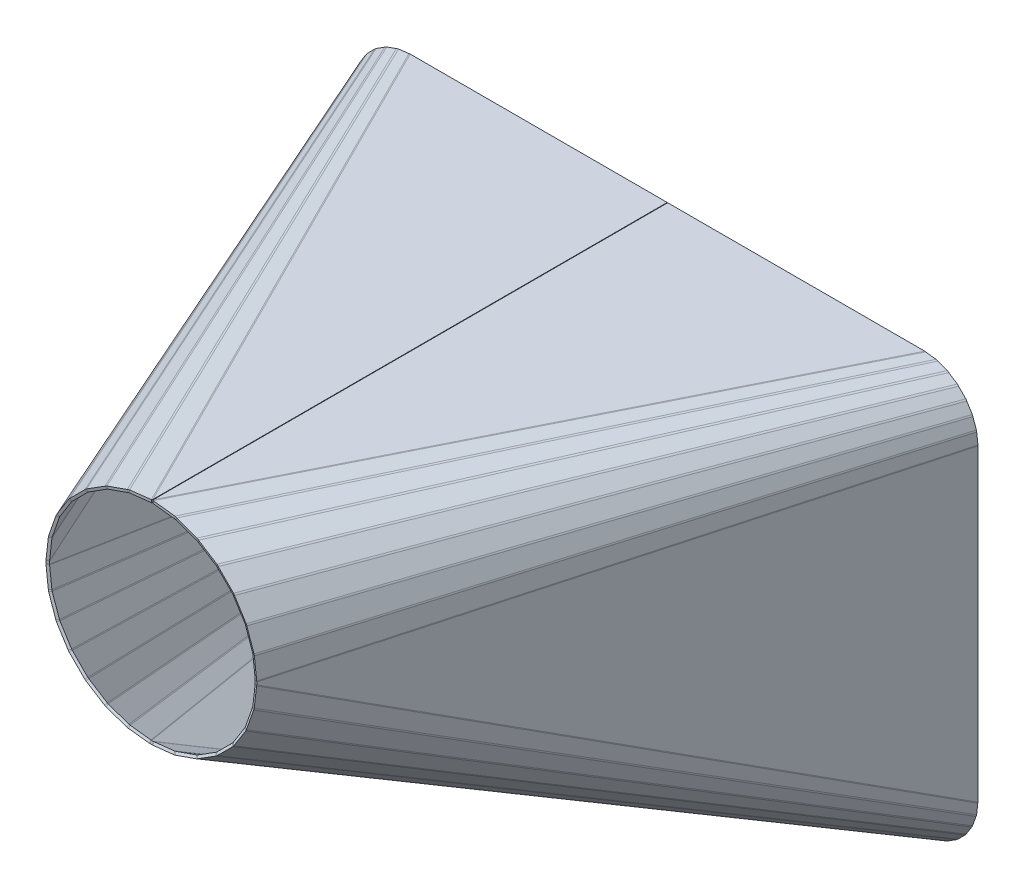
SolidWorks part; units mm, degrees
ref_plane "Front Plane" through (0, 0, 0) normal (0, 0, 1) x (1, 0, 0)
ref_plane "Top Plane" through (0, 0, 0) normal (0, 1, 0) x (1, 0, 0)
ref_plane "Right Plane" through (0, 0, 0) normal (1, 0, 0) x (0, 0, -1)
sketch "Rect Profile" plane through (0, 0, 0) normal (0, 0, 1) x (1, 0, 0)
  line L0 (0, -400) -> (0, 0) construction
  line L1 (-250, 0) -> (-0.25, 0)
  line L2 (-300, -50) -> (-300, -350)
  line L3 (-250, -400) -> (250, -400)
  line L4 (300, -50) -> (300, -350)
  line L5 (0.25, 0) -> (250, 0)
  arc A0 (-300, -350) -> (-250, -400) centre (-250, -350) ccw
  arc A1 (250, -400) -> (300, -350) centre (250, -350) ccw
  arc A2 (250, 0) -> (300, -50) centre (250, -50) cw
  arc A3 (-250, 0) -> (-300, -50) centre (-250, -50) ccw
  point P9 (-300, -400)
  point P14 (300, -400)
  point P17 (300, 0)
ref_plane "Transition Height" through (0, 0, 500) normal (0, 0, 1) x (1, 0, 0)
sketch "Circ Profile" plane through (0, 0, 500) normal (0, 0, 1) x (1, 0, 0)
  line L0 (0, -100) -> (0, 0) construction
  arc A1 (-0.25, -0.0003) -> (0.25, -0.0003) centre (0, -100) ccw
lofted bend "Lofted Bends1" parameters "D1"=0, "D13"=0.5, "D15"=5, "D16"=15, "D17"=0.5, "D19"=5, "D20"=15, "D21"=0.5, "D23"=5, "D24"=15, "D25"=0.5, "D27"=5, "D28"=15, "D29"=0.5, "D31"=5, "D32"=15
bend "RoundBend1" bend radius 5.08 bend angle 7.327 parameters "D5"=1
bend "RoundBend2" bend radius 5.08 bend angle 5.964 parameters "D5"=2
bend "RoundBend3" bend radius 5.08 bend angle 11.886 parameters "D5"=3
bend "RoundBend4" bend radius 5.08 bend angle 12.032 parameters "D5"=4
bend "RoundBend5" bend radius 5.08 bend angle 12.396 parameters "D5"=5
bend "RoundBend6" bend radius 5.08 bend angle 12.925 parameters "D5"=6
bend "RoundBend7" bend radius 5.08 bend angle 13.522 parameters "D5"=7
bend "RoundBend8" bend radius 5.08 bend angle 14.045 parameters "D5"=8
bend "RoundBend9" bend radius 5.08 bend angle 6.448 parameters "D5"=9
bend "RoundBend10" bend radius 5.08 bend angle 6.45 parameters "D5"=10
bend "RoundBend11" bend radius 5.08 bend angle 12.149 parameters "D5"=11
bend "RoundBend12" bend radius 5.08 bend angle 11.422 parameters "D5"=12
bend "RoundBend13" bend radius 5.08 bend angle 11.05 parameters "D5"=13
bend "RoundBend14" bend radius 5.08 bend angle 11.05 parameters "D5"=14
bend "RoundBend15" bend radius 5.08 bend angle 11.422 parameters "D5"=15
bend "RoundBend16" bend radius 5.08 bend angle 12.149 parameters "D5"=16
bend "RoundBend17" bend radius 5.08 bend angle 6.45 parameters "D5"=17
bend "RoundBend18" bend radius 5.08 bend angle 6.448 parameters "D5"=18
bend "RoundBend19" bend radius 5.08 bend angle 12.149 parameters "D5"=19
bend "RoundBend20" bend radius 5.08 bend angle 11.422 parameters "D5"=20
bend "RoundBend21" bend radius 5.08 bend angle 11.05 parameters "D5"=21
bend "RoundBend22" bend radius 5.08 bend angle 11.05 parameters "D5"=22
bend "RoundBend23" bend radius 5.08 bend angle 11.422 parameters "D5"=23
bend "RoundBend24" bend radius 5.08 bend angle 12.149 parameters "D5"=24
bend "RoundBend25" bend radius 5.08 bend angle 5.964 parameters "D5"=25
bend "RoundBend26" bend radius 5.08 bend angle 7.327 parameters "D5"=26
bend "RoundBend27" bend radius 5.08 bend angle 14.045 parameters "D5"=27
bend "RoundBend28" bend radius 5.08 bend angle 13.522 parameters "D5"=28
bend "RoundBend29" bend radius 5.08 bend angle 12.925 parameters "D5"=29
bend "RoundBend30" bend radius 5.08 bend angle 12.396 parameters "D5"=30
bend "RoundBend31" bend radius 5.08 bend angle 12.032 parameters "D5"=31
bend "RoundBend32" bend radius 5.08 bend angle 11.886 parameters "D5"=32
sketch "Bend-Lines1" [suppressed] plane through (0, 0, 0) normal (0, 1, 0) x (1, 0, 0)
sketch "Bounding-Box1" [suppressed] plane through (0, 0, 0) normal (0, 1, 0) x (1, 0, 0)
sheet metal parameters "Sheet-Metal1" thickness 2.6568 parameters "D1"=5.08
flat pattern "Flat-Pattern1"
sketch "Bend-Lines2" plane through (0, -344.7696, 137.9919) normal (0, 0.9284, -0.3716) x (1, 0, 0)
  line L0 (-160.348, -461.8658) -> (-552.607, -90.1847) construction
  line L1 (-175.0026, -479.1109) -> (-560.0295, -98.9056) construction
  line L2 (-188.2211, -497.4826) -> (-566.7382, -108.1896) construction
  line L3 (-200.0623, -516.775) -> (-572.7642, -117.9349) construction
  line L4 (-210.7059, -536.7574) -> (-578.1985, -128.0266) construction
  line L5 (-220.4549, -557.1944) -> (-583.1929, -138.3464) construction
  line L6 (-229.9203, -577.4944) -> (-587.8914, -148.7299) construction
  line L7 (-145.4488, -447.0205) -> (-544.5513, -82.1425) construction
  line L8 (-22.6153, -391.0124) -> (-261.4355, 147.9948) construction
  line L9 (-45.0246, -394.3323) -> (-272.7643, 146.2816) construction
  line L10 (-66.9348, -400.0682) -> (-283.8387, 143.365) construction
  line L11 (-88.0472, -408.2616) -> (-294.5132, 139.2224) construction
  line L12 (-108.0907, -418.8073) -> (-304.6559, 133.9049) construction
  line L13 (-126.873, -431.4733) -> (-314.1746, 127.5275) construction
  line L14 (-143.0917, -444.9021) -> (-322.9744, 120.3008) construction
  line L15 (-1.1464, -389.9655) -> (-250.0644, 148.5963) construction
  line L16 (314.1746, 127.5275) -> (126.873, -431.4733) construction
  line L17 (304.6559, 133.9049) -> (108.0907, -418.8074) construction
  line L18 (294.5132, 139.2224) -> (88.0472, -408.2616) construction
  line L19 (283.8388, 143.365) -> (66.9348, -400.0682) construction
  line L20 (272.7643, 146.2816) -> (45.0246, -394.3323) construction
  line L21 (261.4355, 147.9948) -> (22.6153, -391.0124) construction
  line L22 (250.0645, 148.5963) -> (1.1464, -389.9655) construction
  line L23 (322.9745, 120.3008) -> (143.0935, -444.9036) construction
  line L24 (583.1929, -138.3465) -> (220.4549, -557.1946) construction
  line L25 (578.1985, -128.0266) -> (210.7059, -536.7575) construction
  line L26 (572.7642, -117.9349) -> (200.0623, -516.7751) construction
  line L27 (566.7382, -108.1896) -> (188.2211, -497.4826) construction
  line L28 (560.0295, -98.9056) -> (175.0026, -479.1109) construction
  line L29 (552.607, -90.1847) -> (160.3481, -461.8659) construction
  line L30 (544.5513, -82.1424) -> (145.4471, -447.0189) construction
  line L31 (587.8914, -148.7299) -> (229.9203, -577.4944) construction
  line L32 (-160.348, -461.8658) -> (-552.607, -90.1847) construction
  line L33 (-175.0026, -479.1109) -> (-560.0295, -98.9056) construction
  line L34 (-188.2211, -497.4826) -> (-566.7382, -108.1896) construction
  line L35 (-200.0623, -516.775) -> (-572.7642, -117.9349) construction
  line L36 (-210.7059, -536.7574) -> (-578.1985, -128.0266) construction
  line L37 (-220.4549, -557.1944) -> (-583.1929, -138.3464) construction
  line L38 (-229.9203, -577.4944) -> (-587.8914, -148.7299) construction
  line L39 (-145.4488, -447.0205) -> (-544.5513, -82.1425) construction
  line L40 (-22.6153, -391.0124) -> (-261.4355, 147.9948) construction
  line L41 (-45.0246, -394.3323) -> (-272.7643, 146.2816) construction
  line L42 (-66.9348, -400.0682) -> (-283.8387, 143.365) construction
  line L43 (-88.0472, -408.2616) -> (-294.5132, 139.2224) construction
  line L44 (-108.0907, -418.8073) -> (-304.6559, 133.9049) construction
  line L45 (-126.873, -431.4733) -> (-314.1746, 127.5275) construction
  line L46 (-143.0917, -444.9021) -> (-322.9744, 120.3008) construction
  line L47 (-1.1464, -389.9655) -> (-250.0644, 148.5963) construction
  line L48 (314.1746, 127.5275) -> (126.873, -431.4733) construction
  line L49 (304.6559, 133.9049) -> (108.0907, -418.8074) construction
  line L50 (294.5132, 139.2224) -> (88.0472, -408.2616) construction
  line L51 (283.8388, 143.365) -> (66.9348, -400.0682) construction
  line L52 (272.7643, 146.2816) -> (45.0246, -394.3323) construction
  line L53 (261.4355, 147.9948) -> (22.6153, -391.0124) construction
  line L54 (250.0645, 148.5963) -> (1.1464, -389.9655) construction
  line L55 (322.9745, 120.3008) -> (143.0935, -444.9036) construction
  line L56 (583.1929, -138.3465) -> (220.4549, -557.1946) construction
  line L57 (578.1985, -128.0266) -> (210.7059, -536.7575) construction
  line L58 (572.7642, -117.9349) -> (200.0623, -516.7751) construction
  line L59 (566.7382, -108.1896) -> (188.2211, -497.4826) construction
  line L60 (560.0295, -98.9056) -> (175.0026, -479.1109) construction
  line L61 (552.607, -90.1847) -> (160.3481, -461.8659) construction
  line L62 (544.5513, -82.1424) -> (145.4471, -447.0189) construction
  line L63 (587.8914, -148.7299) -> (229.9203, -577.4944) construction
sketch3d "Bounding-Box2" [suppressed]
  line L0 (687.9469, 148.6343, 0) -> (-687.9469, 148.6343, 0) construction
  line L1 (687.9469, -577.5691, 0) -> (-687.9469, -577.5691, 0) construction
  line L2 (687.9469, 148.6343, 0) -> (687.9469, -577.5691, 0) construction
  line L3 (-687.9469, 148.6343, 0) -> (-687.9469, -577.5691, 0) construction
bend of the flat pattern "Flatten-<RoundBend1>1"
bend of the flat pattern "Flatten-<RoundBend2>1"
bend of the flat pattern "Flatten-<RoundBend3>1"
bend of the flat pattern "Flatten-<RoundBend4>1"
bend of the flat pattern "Flatten-<RoundBend5>1"
bend of the flat pattern "Flatten-<RoundBend6>1"
bend of the flat pattern "Flatten-<RoundBend7>1"
bend of the flat pattern "Flatten-<RoundBend8>1"
bend of the flat pattern "Flatten-<RoundBend9>1"
bend of the flat pattern "Flatten-<RoundBend10>1"
bend of the flat pattern "Flatten-<RoundBend11>1"
bend of the flat pattern "Flatten-<RoundBend12>1"
bend of the flat pattern "Flatten-<RoundBend13>1"
bend of the flat pattern "Flatten-<RoundBend14>1"
bend of the flat pattern "Flatten-<RoundBend15>1"
bend of the flat pattern "Flatten-<RoundBend16>1"
bend of the flat pattern "Flatten-<RoundBend17>1"
bend of the flat pattern "Flatten-<RoundBend18>1"
bend of the flat pattern "Flatten-<RoundBend19>1"
bend of the flat pattern "Flatten-<RoundBend20>1"
bend of the flat pattern "Flatten-<RoundBend21>1"
bend of the flat pattern "Flatten-<RoundBend22>1"
bend of the flat pattern "Flatten-<RoundBend23>1"
bend of the flat pattern "Flatten-<RoundBend24>1"
bend of the flat pattern "Flatten-<RoundBend25>1"
bend of the flat pattern "Flatten-<RoundBend26>1"
bend of the flat pattern "Flatten-<RoundBend27>1"
bend of the flat pattern "Flatten-<RoundBend28>1"
bend of the flat pattern "Flatten-<RoundBend29>1"
bend of the flat pattern "Flatten-<RoundBend30>1"
bend of the flat pattern "Flatten-<RoundBend31>1"
bend of the flat pattern "Flatten-<RoundBend32>1"
equation "\"Gap\"=0.5"
equation "\"D1@Circ Profile\" = \"Gap\""
equation "\"D3@Rect Profile\"=\"Gap\""
